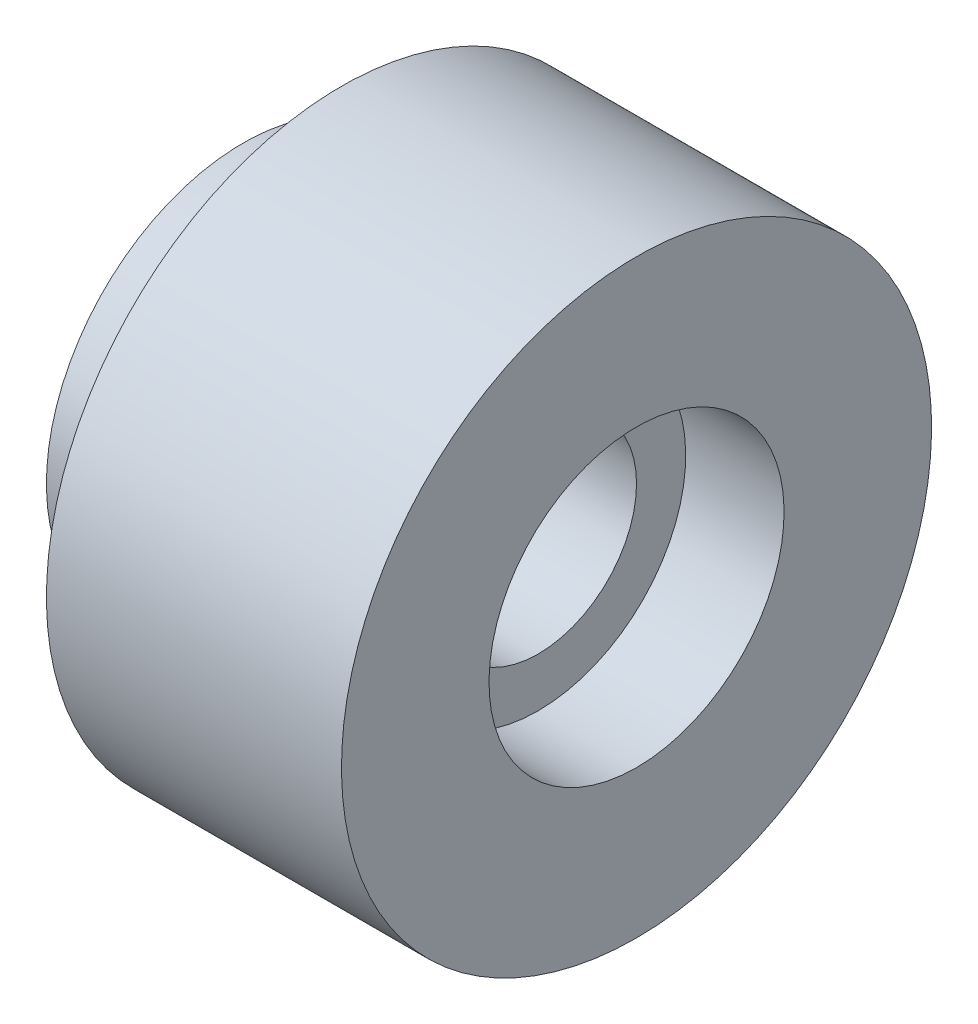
SolidWorks part; units mm, degrees
ref_plane "Płaszczyzna przednia" through (0, 0, 0) normal (0, 0, 1) x (1, 0, 0)
ref_plane "Płaszczyzna górna" through (0, 0, 0) normal (0, 1, 0) x (1, 0, 0)
ref_plane "Płaszczyzna prawa" through (0, 0, 0) normal (1, 0, 0) x (0, 0, -1)
sketch "Szkic1" plane through (0, 0, 0) normal (0, 0, 1) x (1, 0, 0)
  line L0 (0, 5) -> (0, 10)
  line L1 (0, 10) -> (5, 10)
  line L2 (5, 10) -> (5, 15)
  line L3 (5, 15) -> (20, 15)
  line L4 (20, 15) -> (20, 7.5)
  line L5 (20, 7.5) -> (15, 7.5)
  line L6 (15, 7.5) -> (15, 5)
  line L7 (15, 5) -> (0, 5)
  line L8 (0, 0) -> (20, 0) construction
  dimension "D1" = 10
  dimension "D2" = 20
  dimension "D3" = 15
  dimension "D4" = 30
  dimension "D5" = 5
  dimension "D6" = 15
  dimension "D7" = 20
revolve "Obrót1" add sketch "Szkic1" angle 360 about L8
